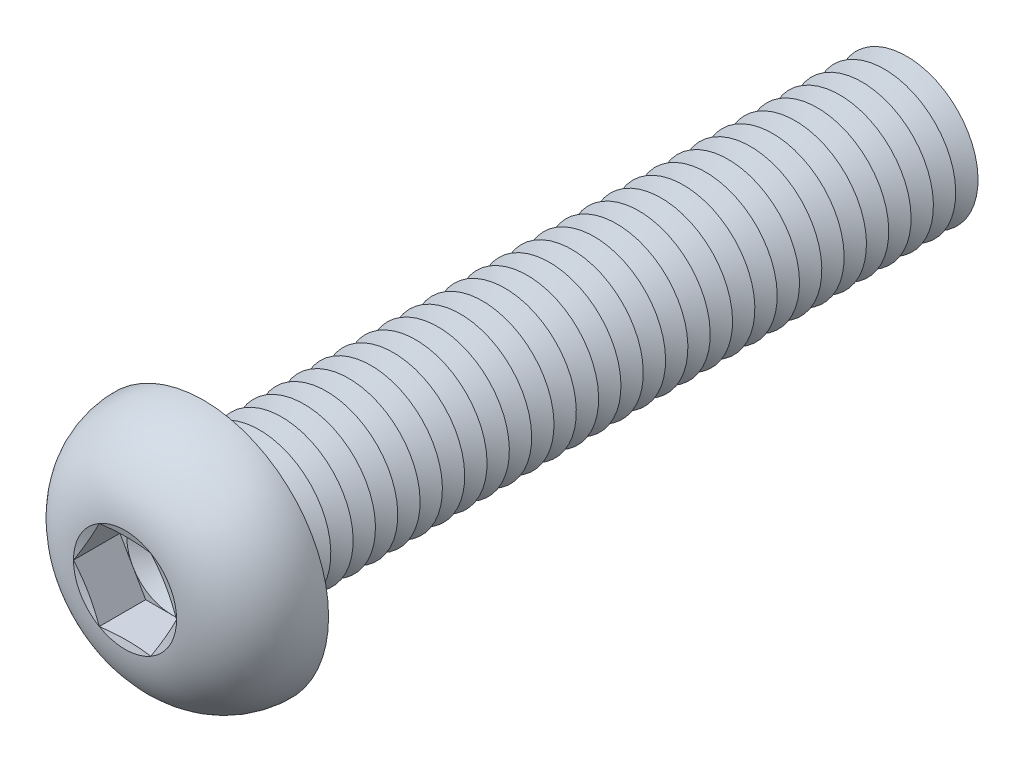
SolidWorks part; units mm, degrees
ref_plane "Front Plane" through (0, 0, 0) normal (0, 0, 1) x (1, 0, 0)
ref_plane "Top Plane" through (0, 0, 0) normal (0, 1, 0) x (1, 0, 0)
ref_plane "Right Plane" through (0, 0, 0) normal (1, 0, 0) x (0, 0, -1)
sketch "Sketch1" plane through (0, 0, 0) normal (1, 0, 0) x (0, 0, -1)
  line L0 (0, 4) -> (0, 7)
  line L3 (0, 4) -> (40, 4)
  line L4 (40, 4) -> (40, 0)
  line L5 (40, 0) -> (-4.4, 0) construction
  line L6 (-4.4, 0) -> (40, 0)
  line L7 (-4.4, 2.8867) -> (-4.4, 1.4434) construction
  line L8 (-4.4, 1.4434) -> (-4.4, 0)
  line L9 (-4.4, 2.8867) -> (-4.0132, 1.4434)
  line L10 (-4.0132, 1.4434) -> (-4.4, 1.4434)
  line L11 (40, 0) -> (22.7481, 0) construction
  line L12 (0, 7) -> (-4.4, 7) construction
  arc A1 (0, 7) -> (-4.4, 2.8867) centre (0, 2.59) ccw
  point P8 (40, 2)
  dimension "D1" = 14
  dimension "D2" = 8
  dimension "D3" = 4.4
  dimension "D4" = 5.7735
  dimension "D5" = 40
  dimension "D6" = 15
revolve "Revolve1" add sketch "Sketch1" angle 360 about L5
fillet "Fillet1" radius 0.625 1 edges at (0, 4, 0)
sketch "Sketch2" plane through (0, 0, 0) normal (1, 0, 0) x (0, 0, -1)
  line L0 (39.375, 4) -> (40.625, 4)
  line L1 (40, 4) -> (0.625, 4) construction
  line L2 (40.625, 4) -> (40, 2.9175)
  line L3 (40, -4) -> (40, 4) construction
  line L4 (40, 2.9175) -> (39.375, 4)
  dimension "D1" = 1.25
revolve "Cut-Revolve1" cut sketch "Sketch2" angle 360 about axis through (0, 0, -40) along (0, 0, -1)
pattern_linear "LPattern1" count 32 spacing 1.25 along (0, 0, 1) of "Cut-Revolve1"
sketch "Sketch3" plane through (0, 0, 4.4) normal (0, 0, 1) x (1, 0, 0)
  line L7 (1.4434, 2.5) -> (-1.4434, 2.5)
  line L8 (-1.4434, 2.5) -> (-2.8867, 0)
  line L9 (-2.8867, 0) -> (-1.4434, -2.5)
  line L10 (-1.4434, -2.5) -> (1.4434, -2.5)
  line L11 (1.4434, -2.5) -> (2.8867, 0)
  line L12 (2.8867, 0) -> (1.4434, 2.5)
  circle A0 centre (0, 0) radius 2.5 construction
  circle A3 centre (0, 0) radius 2.8867 construction
extrude "Cut-Extrude1" cut sketch "Sketch3" against normal blind 2.6
sketch "Sketch4" plane through (0, 0, 1.8) normal (0, 0, 1) x (1, 0, 0)
  line L1 (1.4434, 2.5) -> (-1.4434, 2.5) construction
  circle A0 centre (0, 0) radius 2.5
extrude "Cut-Extrude2" cut sketch "Sketch4" against normal through all draft 60
